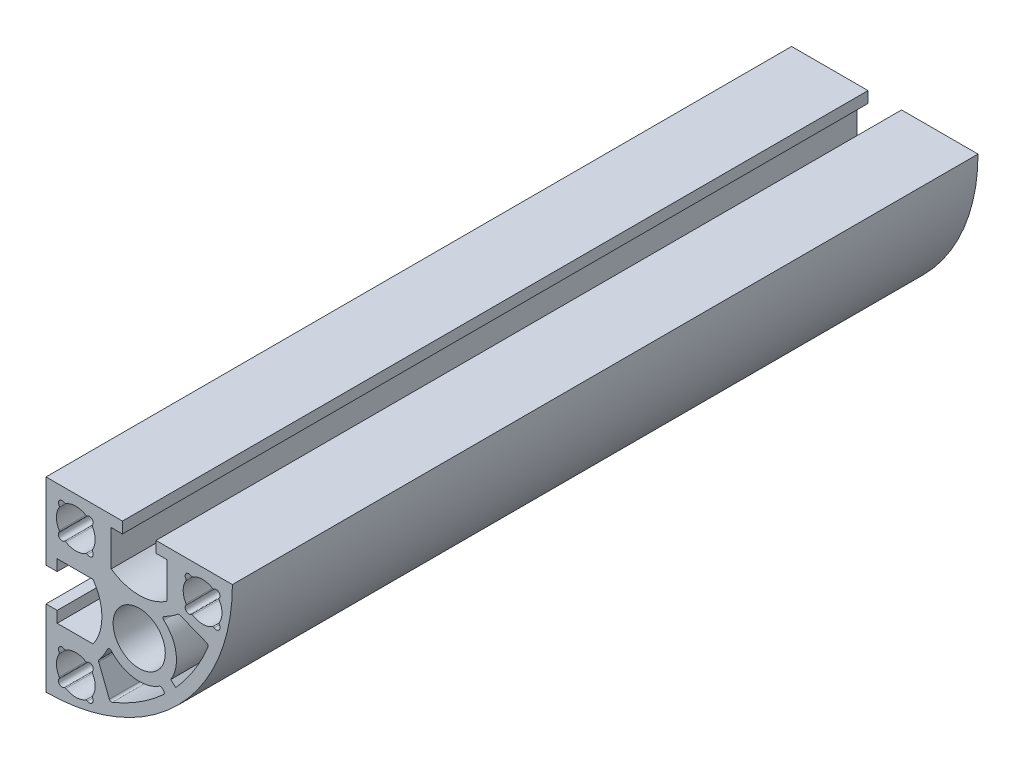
SolidWorks part; units mm, degrees
ref_plane "前基準面" through (0, 0, 0) normal (0, 0, 1) x (1, 0, 0)
ref_plane "上基準面" through (0, 0, 0) normal (0, 1, 0) x (1, 0, 0)
ref_plane "右基準面" through (0, 0, 0) normal (1, 0, 0) x (0, 0, -1)
sketch "草圖1" plane through (0, 0, 0) normal (0, 0, 1) x (1, 0, 0)
  line L0 (-28, 0) -> (0, 0) construction
  line L1 (0, 0) -> (0, 28) construction
  line L2 (-11, 3.75) -> (-6.1908, 3.75)
  line L3 (-12.5, 12.5) -> (-2.25, 12.5)
  line L4 (-2.25, 12.5) -> (-2.25, 11)
  line L5 (-2.25, 11) -> (-3.75, 11)
  line L6 (-3.75, 11) -> (-3.75, 6.1908)
  line L7 (-12.5, 12.5) -> (0, 0) construction
  line L8 (-12.5, 2.25) -> (-11, 2.25)
  line L9 (-12.5, 12.5) -> (-12.5, 2.25)
  line L10 (-11, 2.25) -> (-11, 3.75)
  line L11 (-5.428, -5.4534) -> (-4.0035, -9.0697)
  line L12 (3.6302, -3.4228) -> (5.2917, -5.0629) construction
  line L13 (3.0853, -4.2541) -> (3.2893, -4.4734)
  line L14 (4.2308, -2.6646) -> (4.9, -3.2711)
  line L15 (-12.5, 12.5) -> (-3.8928, -9.3507) construction
  line L16 (12.5, 12.5) -> (0, 0) construction
  line L17 (-12.5, 12.5) -> (3.4949, -4.6944) construction
  line L18 (5.4534, 5.428) -> (9.0697, 4.0035)
  line L24 (3.75, 11) -> (3.75, 6.1908)
  line L25 (2.25, 11) -> (3.75, 11)
  line L26 (2.25, 12.5) -> (2.25, 11)
  line L27 (12.5, 12.5) -> (2.25, 12.5)
  line L53 (-11, -2.25) -> (-11, -3.75)
  line L54 (-11, -3.75) -> (-6.1908, -3.75)
  line L55 (-12.5, -2.25) -> (-11, -2.25)
  line L56 (-12.5, -12.5) -> (-12.5, -2.25)
  arc A0 (-3.75, 6.1908) -> (3.75, 6.1908) centre (0, 11.5) ccw
  arc A1 (-10.7352, 9.8281) -> (-10.7352, 7.1719) centre (-8.5, 8.5) ccw
  arc A2 (-6.1908, 3.75) -> (-6.1908, -3.75) centre (-11.5, 0) cw
  arc A3 (3.2893, -4.4734) -> (3.2711, -4.9) centre (3.0696, -4.6777) cw
  circle A4 centre (0, 0) radius 3.5
  arc A5 (-3.751, -3.306) -> (2.7035, -4.2061) centre (0, 0) ccw
  arc A6 (-4.248, -3.3777) -> (-5.3784, -5.1503) centre (-11.5, 0) cw
  arc A7 (3.0853, -4.2541) -> (2.7035, -4.2061) centre (2.8657, -4.4585) ccw
  circle A8 centre (0, 0) radius 5 construction
  arc A9 (-10.0469, 10.7447) -> (-10.7447, 10.0469) centre (-10.3385, 10.3385) ccw
  arc A10 (-6.2553, 10.0469) -> (-6.9531, 10.7447) centre (-6.6615, 10.3385) ccw
  arc A11 (-6.9531, 6.2553) -> (-6.2553, 6.9531) centre (-6.6615, 6.6615) ccw
  arc A12 (-10.7447, 6.9531) -> (-10.0469, 6.2553) centre (-10.3385, 6.6615) ccw
  arc A13 (-7.1719, 10.7352) -> (-9.8281, 10.7352) centre (-8.5, 8.5) ccw
  arc A14 (-6.2648, 7.1719) -> (-6.2648, 9.8281) centre (-8.5, 8.5) ccw
  arc A15 (-9.8281, 6.2648) -> (-7.1719, 6.2648) centre (-8.5, 8.5) ccw
  arc A16 (-10.7447, 6.9531) -> (-10.7352, 7.1719) centre (-10.9071, 7.0697) ccw
  arc A17 (-10.0469, 6.2553) -> (-9.8281, 6.2648) centre (-9.9303, 6.0929) cw
  arc A18 (-6.9531, 6.2553) -> (-7.1719, 6.2648) centre (-7.0697, 6.0929) ccw
  arc A19 (-6.2553, 6.9531) -> (-6.2648, 7.1719) centre (-6.0929, 7.0697) cw
  arc A20 (-6.2553, 10.0469) -> (-6.2648, 9.8281) centre (-6.0929, 9.9303) ccw
  arc A21 (-6.9531, 10.7447) -> (-7.1719, 10.7352) centre (-7.0697, 10.9071) cw
  arc A22 (-10.0469, 10.7447) -> (-9.8281, 10.7352) centre (-9.9303, 10.9071) ccw
  arc A23 (-10.7447, 10.0469) -> (-10.7352, 9.8281) centre (-10.9071, 9.9303) cw
  arc A24 (10.7447, 10.0469) -> (10.7352, 9.8281) centre (10.9071, 9.9303) ccw
  arc A25 (10.0469, 10.7447) -> (9.8281, 10.7352) centre (9.9303, 10.9071) cw
  arc A26 (6.9531, 10.7447) -> (7.1719, 10.7352) centre (7.0697, 10.9071) ccw
  arc A27 (6.2553, 10.0469) -> (6.2648, 9.8281) centre (6.0929, 9.9303) cw
  arc A28 (6.2553, 6.9531) -> (6.2648, 7.1719) centre (6.0929, 7.0697) ccw
  arc A29 (6.9531, 6.2553) -> (7.1719, 6.2648) centre (7.0697, 6.0929) cw
  arc A30 (10.0469, 6.2553) -> (9.8281, 6.2648) centre (9.9303, 6.0929) ccw
  arc A31 (10.7447, 6.9531) -> (10.7352, 7.1719) centre (10.9071, 7.0697) cw
  arc A32 (9.8281, 6.2648) -> (7.1719, 6.2648) centre (8.5, 8.5) cw
  arc A33 (6.2648, 7.1719) -> (6.2648, 9.8281) centre (8.5, 8.5) cw
  arc A34 (7.1719, 10.7352) -> (9.8281, 10.7352) centre (8.5, 8.5) cw
  arc A35 (10.7447, 6.9531) -> (10.0469, 6.2553) centre (10.3385, 6.6615) cw
  arc A36 (6.9531, 6.2553) -> (6.2553, 6.9531) centre (6.6615, 6.6615) cw
  arc A37 (6.2553, 10.0469) -> (6.9531, 10.7447) centre (6.6615, 10.3385) cw
  arc A38 (10.0469, 10.7447) -> (10.7447, 10.0469) centre (10.3385, 10.3385) cw
  arc A39 (-4.248, -3.3777) -> (-3.751, -3.306) centre (-3.9761, -3.5044) cw
  arc A40 (4.2308, -2.6646) -> (3.306, 3.751) centre (0, 0) ccw
  arc A41 (-3.6107, -9.2374) -> (3.2711, -4.9) centre (-12.511, 12.512) ccw
  arc A42 (-5.428, -5.4534) -> (-5.3784, -5.1503) centre (-5.1488, -5.3435) cw
  arc A43 (-4.0035, -9.0697) -> (-3.6107, -9.2374) centre (-3.7243, -8.9598) ccw
  arc A44 (9.0697, 4.0035) -> (9.2374, 3.6107) centre (8.9598, 3.7243) cw
  arc A45 (10.7352, 9.8281) -> (10.7352, 7.1719) centre (8.5, 8.5) cw
  circle A46 centre (-8.5, 8.5) radius 2.6 construction
  arc A47 (-10.7447, -10.0469) -> (-10.7352, -9.8281) centre (-10.9071, -9.9303) ccw
  arc A48 (-10.0469, -10.7447) -> (-9.8281, -10.7352) centre (-9.9303, -10.9071) cw
  arc A49 (-6.9531, -10.7447) -> (-7.1719, -10.7352) centre (-7.0697, -10.9071) ccw
  arc A50 (-6.2553, -10.0469) -> (-6.2648, -9.8281) centre (-6.0929, -9.9303) cw
  arc A51 (-6.2553, -6.9531) -> (-6.2648, -7.1719) centre (-6.0929, -7.0697) ccw
  arc A52 (-6.9531, -6.2553) -> (-7.1719, -6.2648) centre (-7.0697, -6.0929) cw
  arc A53 (-10.0469, -6.2553) -> (-9.8281, -6.2648) centre (-9.9303, -6.0929) ccw
  arc A54 (-10.7447, -6.9531) -> (-10.7352, -7.1719) centre (-10.9071, -7.0697) cw
  arc A55 (-9.8281, -6.2648) -> (-7.1719, -6.2648) centre (-8.5, -8.5) cw
  arc A56 (-6.2648, -7.1719) -> (-6.2648, -9.8281) centre (-8.5, -8.5) cw
  arc A57 (-7.1719, -10.7352) -> (-9.8281, -10.7352) centre (-8.5, -8.5) cw
  arc A58 (-10.7447, -6.9531) -> (-10.0469, -6.2553) centre (-10.3385, -6.6615) cw
  arc A59 (-6.9531, -6.2553) -> (-6.2553, -6.9531) centre (-6.6615, -6.6615) cw
  arc A60 (-6.2553, -10.0469) -> (-6.9531, -10.7447) centre (-6.6615, -10.3385) cw
  arc A61 (-10.0469, -10.7447) -> (-10.7447, -10.0469) centre (-10.3385, -10.3385) cw
  arc A62 (-10.7352, -9.8281) -> (-10.7352, -7.1719) centre (-8.5, -8.5) cw
  arc A63 (9.2374, 3.6107) -> (4.9, -3.2711) centre (-12.512, 12.511) cw
  arc A64 (3.3777, 4.248) -> (3.306, 3.751) centre (3.5044, 3.9761) ccw
  arc A65 (3.3777, 4.248) -> (5.1503, 5.3784) centre (0, 11.5) ccw
  arc A66 (5.4534, 5.428) -> (5.1503, 5.3784) centre (5.3435, 5.1488) ccw
  arc A68 (-12.5, -12.5) -> (12.5, 12.5) centre (-12.5, 12.5) ccw
  point P50 (-8.5, 8.5)
  point P85 (2.9102, -4.0658)
  point P90 (-5.4943, -5.285)
  dimension "D3" = 7.5
  dimension "D2" = 4.5
  dimension "D9" = 5.2
  dimension "D11" = 25
  dimension "D12" = 8
  dimension "D5" = 7
  dimension "D7" = 6.5
  dimension "D15" = 4.885
  dimension "D16" = 2
  dimension "D20" = 0.5
  dimension "D14" = 0.2
  dimension "D4" = 25
  dimension "D17" = 23.5
  dimension "D19" = 0.3
  dimension "D6" = 1.5
  dimension "D8" = 1
  dimension "D13" = 1.5
  dimension "D10" = 17
  dimension "D18" = 21.5
  dimension "D21" = 2.6
  dimension "D22" = 4
extrude "填料-伸長1" add sketch "草圖1" along normal mid plane 100
